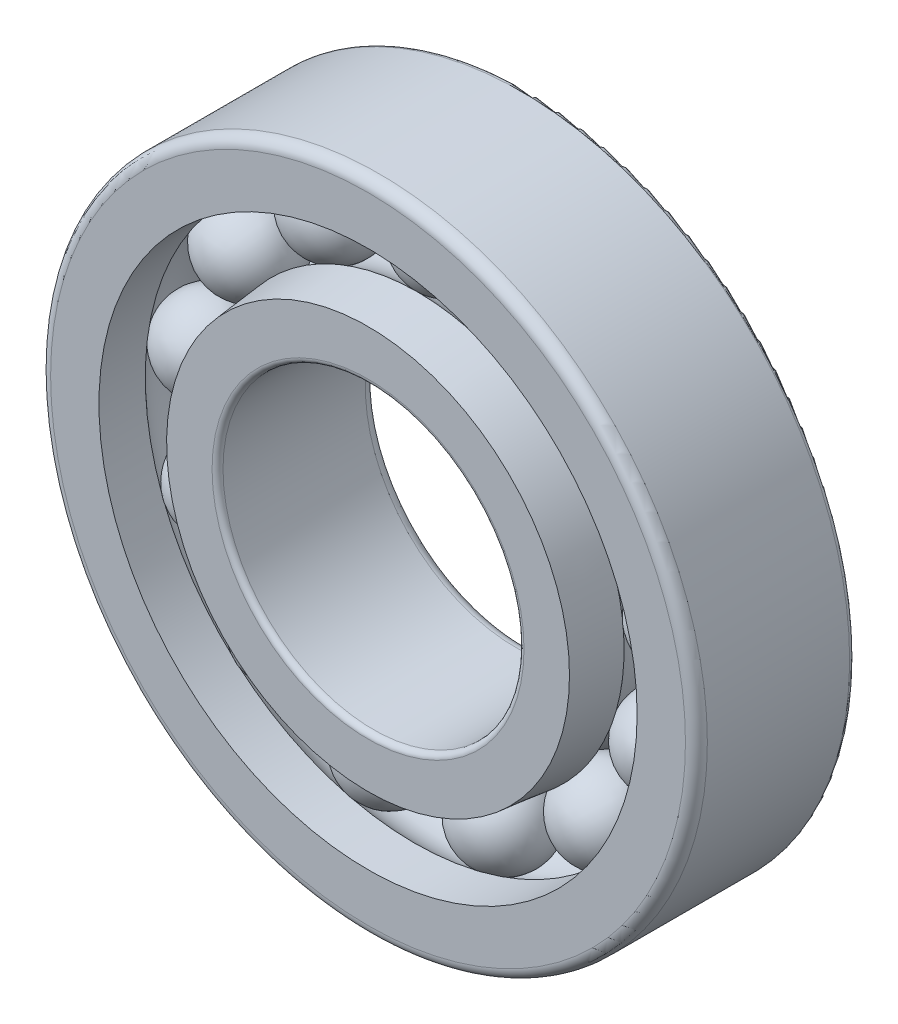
SolidWorks part; units mm, degrees
ref_plane "Front Plane" through (0, 0, 0) normal (0, 0, 1) x (1, 0, 0)
ref_plane "Top Plane" through (0, 0, 0) normal (0, 1, 0) x (1, 0, 0)
ref_plane "Right Plane" through (0, 0, 0) normal (1, 0, 0) x (0, 0, -1)
sketch "BaseSke" plane through (0, 0, 0) normal (1, 0, 0) x (0, 0, -1)
  line L0 (-47.2296, 0) -> (24.6132, 0) construction
  line L1 (-47.2296, 43.75) -> (24.6132, 43.75) construction
  line L2 (0, 129.5214) -> (0, -86.3012) construction
  line L3 (0, 51.875) -> (0, 35.625)
  line L4 (-14.5, 60) -> (14.5, 60) construction
  line L5 (-14.5, 27.5) -> (14.5, 27.5) construction
  arc A0 (0, 51.875) -> (0, 35.625) centre (0, 43.75) ccw
revolve "Ball" add sketch "BaseSke" angle 360 about L3
sketch "OuterRaceSke" plane through (0, 0, 0) normal (1, 0, 0) x (0, 0, -1)
  line L0 (0, 0) -> (0, 87.5396) construction
  line L1 (-14.5, 60) -> (14.5, 60)
  line L2 (-14.5, 60) -> (-14.5, 49.1667)
  line L3 (-14.5, 49.1667) -> (-6.0426, 49.1667)
  line L4 (14.5, 60) -> (14.5, 50.6907)
  line L5 (-50.3916, 0) -> (55.2197, 0) construction
  line L6 (-47.2296, 43.75) -> (24.6132, 43.75) construction
  line L8 (14.5, 50.6907) -> (5.4727, 49.7419)
  line L9 (0, 49.1667) -> (-2.5325, 58.6181) construction
  line L10 (0, 49.1667) -> (5.4727, 49.7419) construction
  arc A0 (5.4727, 49.7419) -> (-6.0426, 49.1667) centre (0, 43.75) ccw
revolve "OuterRace" add sketch "OuterRaceSke" angle 360 about L5
sketch "InnerRaceSke" plane through (0, 0, 0) normal (1, 0, 0) x (0, 0, -1)
  line L0 (-70.8626, 0) -> (113.5527, 0) construction
  line L1 (0, 58.441) -> (0, -70.8113) construction
  line L2 (-14.5, 27.5) -> (14.5, 27.5)
  line L3 (-14.5, 27.5) -> (-14.5, 38.3333)
  line L4 (-14.5, 38.3333) -> (-6.0426, 38.3333)
  line L5 (14.5, 27.5) -> (14.5, 38.3333)
  line L6 (0, 129.5214) -> (0, -86.3012) construction
  line L7 (6.0426, 38.3333) -> (14.5, 38.3333)
  arc A0 (-6.0426, 38.3333) -> (6.0426, 38.3333) centre (0, 43.75) ccw
  arc A1 (0, 51.875) -> (0, 35.625) centre (0, 43.75) ccw construction
revolve "InnerRace" add sketch "InnerRaceSke" angle 360 about L0
fillet "Fillet1" radius 2 2 edges at (27.5, 0, -14.5) (60, 0, 14.5)
fillet "Fillet2" radius 1 2 edges at (60, 0, -14.5) (27.5, 0, 14.5)
sketch "CutInnerRaceSke" plane through (0, 0, 0) normal (1, 0, 0) x (0, 0, -1)
  line L0 (-6.0426, 38.3333) -> (-14.5, 38.3333)
  line L1 (-14.5, 38.3333) -> (-14.5, 36.8093)
  line L2 (-14.5, 36.8093) -> (-5.4727, 37.7581)
  line L3 (-5.4727, 37.7581) -> (0, 38.3333) construction
  line L4 (0, 58.441) -> (0, -70.8113) construction
  line L5 (-28.3066, 0) -> (35.2466, 0) construction
  arc A0 (-6.0426, 38.3333) -> (-5.4727, 37.7581) centre (0, 43.75) ccw
  arc A1 (-6.0426, 38.3333) -> (6.0426, 38.3333) centre (0, 43.75) ccw construction
revolve "CutInnerRace" cut sketch "CutInnerRaceSke" angle 360 about L5
pattern_circular "CirPatternBall" count 13 over 360 about axis through (0, 0, 0) along (0, 0, 1) of "Ball"
sketch "SimplifiedSke" plane through (0, 0, 0) normal (1, 0, 0) x (0, 0, -1)
  line L0 (37.5911, 0) -> (-37.5911, 0) construction
  circle A0 centre (0, 43.75) radius 8.125
  arc A1 (0, 51.875) -> (0, 35.625) centre (0, 43.75) ccw construction
revolve "Simplified" [suppressed] add sketch "SimplifiedSke" angle 360 about L0
equation "\"D1@BaseSke\" =  (\"Bearing_Outside_Diameter@BaseSke\"  +  \"Bearing_Inside_Diameter@BaseSke\"  )  / 4"
equation "\"Ball_diameter@BaseSke\" =  ( \"Bearing_Outside_Diameter@BaseSke\" - \"Bearing_Inside_Diameter@BaseSke\" ) / 4 "
equation "\"D2@OuterRaceSke\" = \"Bearing_Outside_Diameter@BaseSke\" -  ( \"Bearing_Outside_Diameter@BaseSke\" - \"Bearing_Inside_Diameter@BaseSke\" )  / 3"
equation "\"D4@OuterRaceSke\" = (  \"Bearing_Outside_Diameter@BaseSke\" - \"Bearing_Inside_Diameter@BaseSke\" ) / 4 -0.02"
equation "\"D3@OuterRaceSke\" = \"Angle@OuterRaceSke\"/2.5"
equation "\"D1@InnerRaceSke\" = \"Bearing_Inside_Diameter@BaseSke\" +  ( \"Bearing_Outside_Diameter@BaseSke\" - \"Bearing_Inside_Diameter@BaseSke\" )  / 3"
equation "\"D2@InnerRaceSke\" = \"D4@OuterRaceSke\""
equation "\"D1@CirPatternBall\" = int( \"D1@BaseSke\"* pi  * 2 / \"Ball_diameter@BaseSke\"/1.2 ) -1"
equation "\"D1@CutInnerRaceSke\" = \"D3@OuterRaceSke\""
